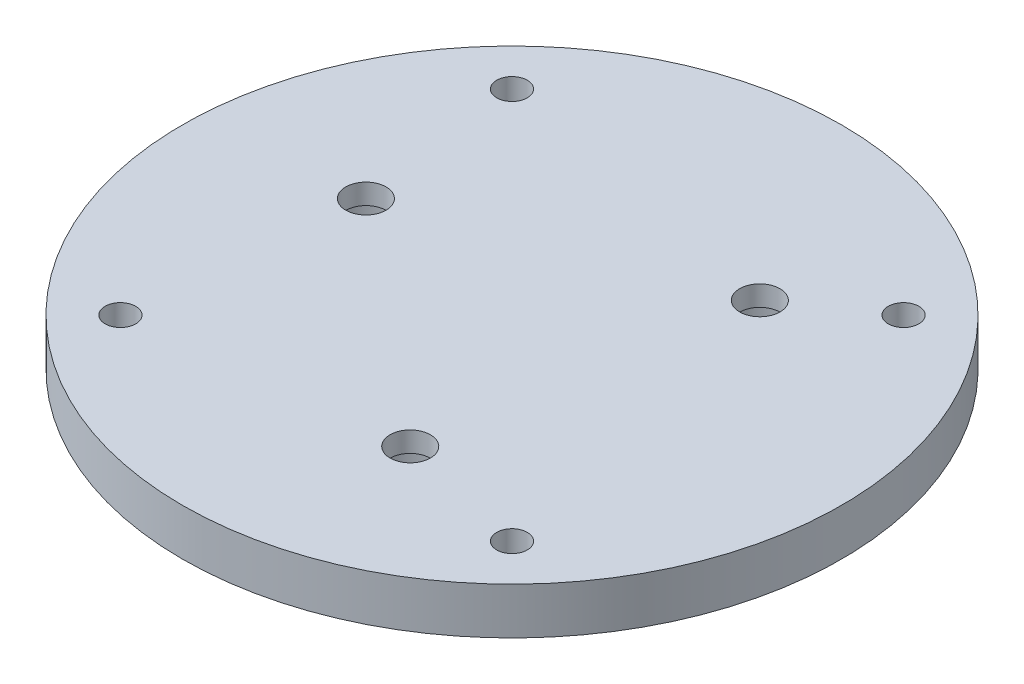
SolidWorks part; units mm, degrees
ref_plane "Front Plane" through (0, 0, 0) normal (0, 0, 1) x (1, 0, 0)
ref_plane "Top Plane" through (0, 0, 0) normal (0, 1, 0) x (1, 0, 0)
ref_plane "Right Plane" through (0, 0, 0) normal (1, 0, 0) x (0, 0, -1)
sketch "Sketch1" plane through (0, 0, 0) normal (0, 1, 0) x (1, 0, 0)
  circle A0 centre (0, 0) radius 44.8945
  dimension "D1" = 89.789
extrude "Boss-Extrude1" add sketch "Sketch1" along normal blind 6.35
hole_wizard "#8-32 Tapped Hole1" positions "Sketch3" profile "Sketch2" tap size "#8-32" standard "ANSI Inch"
sketch "Sketch3" plane through (0, 6.35, 0) normal (0, 1, 0) x (1, 0, 0)
  circle A0 centre (-26.67, -26.67) radius 2.4574 construction
  circle A1 centre (-26.67, 26.67) radius 2.4574 construction
  circle A2 centre (26.67, 26.67) radius 2.4574 construction
  circle A3 centre (26.67, -26.67) radius 2.4574 construction
  point P0 (-26.67, 26.67)
  point P2 (26.67, 26.67)
  point P4 (-26.67, -26.67)
  point P6 (26.67, -26.67)
sketch "Sketch2" plane through (-26.67, 6.35, -26.67) normal (1, 0, 0) x (0, 0, 1)
  line L0 (0, 0) -> (0, 6.35)
  line L1 (0, 6.35) -> (2.0828, 6.35)
  line L2 (2.0828, 6.35) -> (2.0828, 0)
  line L5 (2.0828, 0) -> (0, 0)
  line L11 (0, -6.35) -> (0, 107.95) construction
  dimension "Thread Major Dia." = 4.1656
  dimension "Thru Tap Drill Depth" = 6.35
hole_wizard "CBORE for M5 Hex Head Bolt1" positions "Sketch5" profile "Sketch4" counterbore size "M5" standard "ANSI Metric"
sketch "Sketch5" plane through (0, 0, 0) normal (0, -1, 0) x (-1, 0, 0)
  circle A0 centre (-15.1383, 18.6234) radius 2.1 construction
  circle A1 centre (-8.5592, -22.4219) radius 2.1 construction
  circle A2 centre (23.6975, 3.7984) radius 2.1 construction
  point P0 (-15.1383, 18.6234)
  point P2 (-8.5592, -22.4219)
  point P4 (23.6975, 3.7984)
sketch "Sketch4" plane through (15.1383, 0, -18.6234) normal (1, 0, 0) x (0, 0, -1)
  line L0 (0, 0) -> (0, 6.35)
  line L1 (0, 6.35) -> (2.75, 6.35)
  line L3 (2.75, 6.35) -> (2.75, 3.58)
  line L4 (2.75, 3.58) -> (6.12, 3.58)
  line L5 (6.12, 3.58) -> (6.12, 0)
  line L7 (6.12, 0) -> (0, 0)
  line L11 (0, -6.35) -> (0, 107.95) construction
  dimension "Thru Hole Dia." = 5.5
  dimension "Thru Hole Depth" = 6.35
  dimension "C'Bore Dia." = 12.24
  dimension "C'Bore Depth" = 3.58
